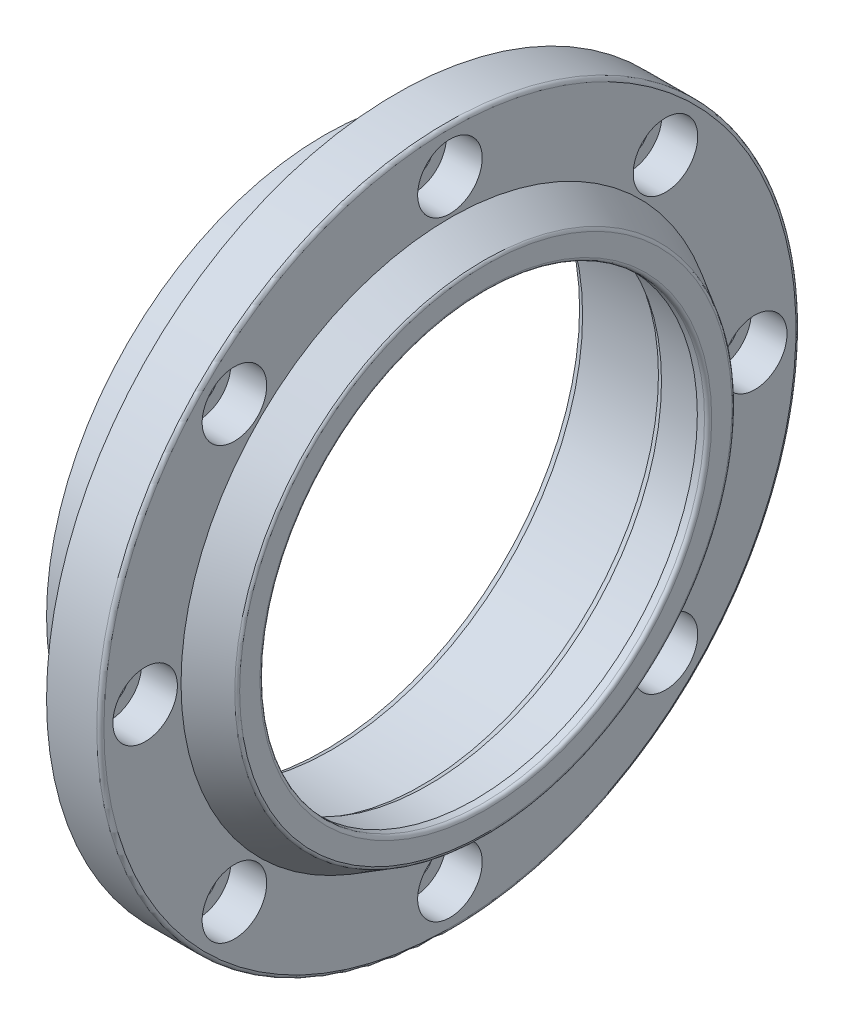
SolidWorks part; units mm, degrees
ref_plane "Plan de face" through (0, 0, 0) normal (0, 0, 1) x (1, 0, 0)
ref_plane "Plan de dessus" through (0, 0, 0) normal (0, 1, 0) x (1, 0, 0)
ref_plane "Plan de droite" through (0, 0, 0) normal (1, 0, 0) x (0, 0, -1)
sketch "Esquisse1" plane through (0, 0, 0) normal (0, 0, 1) x (1, 0, 0)
  line L0 (0, 0) -> (48.0613, 0) construction
  line L1 (0, 70) -> (27, 70)
  line L2 (27, 70) -> (27, 65)
  line L3 (27, 65) -> (42, 65)
  line L4 (42, 65) -> (42, 62)
  line L5 (42, 62) -> (45, 62)
  line L6 (45, 62) -> (45, 69.2265)
  line L7 (45, 69.2265) -> (35, 75)
  line L8 (35, 75) -> (35, 97.5)
  line L9 (35, 97.5) -> (20, 97.5)
  line L10 (20, 97.5) -> (20, 77.5)
  line L11 (20, 77.5) -> (11.8, 77.5)
  line L12 (11.8, 77.5) -> (11.8, 74.4)
  line L13 (11.8, 74.4) -> (7, 74.4)
  line L14 (7, 74.4) -> (7, 77.5)
  line L15 (7, 77.5) -> (0, 77.5)
  line L16 (0, 77.5) -> (0, 70)
  dimension "D1" = 124
  dimension "D2" = 130
  dimension "D3" = 140
  dimension "D4" = 195
  dimension "D5" = 150
  dimension "D6" = 148.8
  dimension "D7" = 155
  dimension "D8" = 27
  dimension "D9" = 42
  dimension "D10" = 7
  dimension "D11" = 20
  dimension "D12" = 4.8
  dimension "D13" = 45
  dimension "D14" = 15
  dimension "D15" = 120
revolve "Révolution1" add sketch "Esquisse1" angle 360 about L0
chamfer "Chanfrein1" distance 2 angle 30 1 edges at (27, 0, 65)
chamfer "Chanfrein2" distance 2 angle 30 1 edges at (0, 0, 70)
fillet "Congé1" radius 1 3 edges at (45, 0, 62) (45, 0, 69.2265) (35, 0, 97.5)
hole_wizard "Chambrage pour vis à tête ronde bombée M51" positions "Esquisse3" profile "Esquisse2" counterbore size "M5" standard "Ansi Métrique"
sketch "Esquisse3" plane through (35, 0, 0) normal (1, 0, 0) x (0, 0, -1)
  line L0 (0, 0) -> (0, 85) construction
  point P0 (0, 85)
  dimension "D1" = 85
sketch "Esquisse2" plane through (35, 85, 0) normal (0, 1, 0) x (0, 0, -1)
  line L0 (0, 0) -> (0, 35)
  line L1 (0, 35) -> (5.5, 35)
  line L3 (5.5, 35) -> (5.5, 10)
  line L4 (5.5, 10) -> (9, 10)
  line L5 (9, 10) -> (9, 0)
  line L7 (9, 0) -> (0, 0)
  line L11 (0, -6.35) -> (0, 107.95) construction
  dimension "Diamètre du perçage jusqu'au prochain" = 11
  dimension "Profondeur du perçage jusqu'au prochain" = 35
  dimension "Diamètre du chambrage" = 18
  dimension "Profondeur du chambrage" = 10
pattern_circular "Répétition circulaire1" count 8 every 45 about axis through (0, 0, 0) along (1, 0, 0) of "Chambrage pour vis à tête ronde bombée M51"
